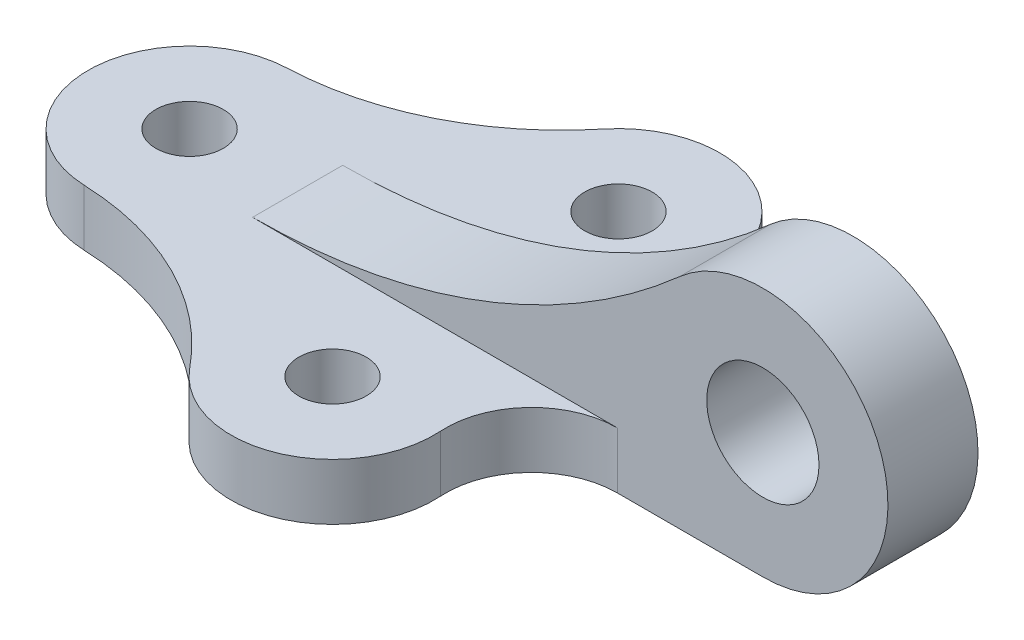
SolidWorks part; units mm, degrees
ref_plane "Front Plane" through (0, 0, 0) normal (0, 0, 1) x (1, 0, 0)
ref_plane "Top Plane" through (0, 0, 0) normal (0, 1, 0) x (1, 0, 0)
ref_plane "Right Plane" through (0, 0, 0) normal (1, 0, 0) x (0, 0, -1)
sketch "Sketch1" plane through (0, 0, 0) normal (0, 1, 0) x (1, 0, 0)
  line L0 (84.0039, 8.001) -> (84.0039, -8.001)
  line L1 (0, 0) -> (84.0039, 0) construction
  arc A0 (-0.6921, 18.0207) -> (-0.6921, -18.0207) centre (0, 0) ccw
  arc A1 (68.796, 24.2299) -> (36.7987, 36.7661) centre (50.8, 25.4) ccw
  arc A2 (36.7987, -36.7661) -> (68.796, -24.2299) centre (50.8, -25.4) ccw
  arc A3 (-0.6921, 18.0207) -> (36.7987, 36.7661) centre (-2.6416, 68.7833) ccw
  arc A4 (-0.6921, -18.0207) -> (36.7987, -36.7661) centre (-2.6416, -68.7833) cw
  arc A5 (68.796, -24.2299) -> (84.0039, -8.001) centre (84.0039, -23.241) cw
  arc A6 (68.796, 24.2299) -> (84.0039, 8.001) centre (84.0039, 23.241) ccw
  circle A7 centre (50.8, 25.4) radius 5.9944
  circle A8 centre (0, 0) radius 5.9944
  circle A9 centre (50.8, -25.4) radius 5.9944
  dimension "D1" = 11.9888
  dimension "D2" = 18.034
  dimension "D3" = 50.8
  dimension "D4" = 15.24
  dimension "D5" = 50.8
  dimension "D6" = 25.4
  dimension "D7" = 50.8
  dimension "D8" = 16.002
extrude "Extrude1" add sketch "Sketch1" along normal blind 10.0076
sketch "Sketch2" plane through (0, 0, 0) normal (0, 0, 1) x (1, 0, 0)
  line L0 (36.7987, 10.0076) -> (-0.6921, 10.0076) construction
  line L1 (109.855, 0) -> (19.2006, 0)
  line L2 (-0.6921, 0) -> (36.7987, 0) construction
  line L3 (19.2006, 0) -> (19.2006, 10.0076)
  arc A0 (19.2006, 10.0076) -> (95.0973, 38.8431) centre (19.2006, 124.3076) ccw
  arc A1 (95.0973, 38.8431) -> (109.855, 0) centre (109.855, 22.225) cw
  circle A2 centre (109.855, 22.225) radius 9.9695
  dimension "D1" = 19.939
  dimension "D2" = 22.225
  dimension "D3" = 114.3
  dimension "D4" = 109.855
extrude "Extrude2" add sketch "Sketch2" along normal mid plane 16.002
